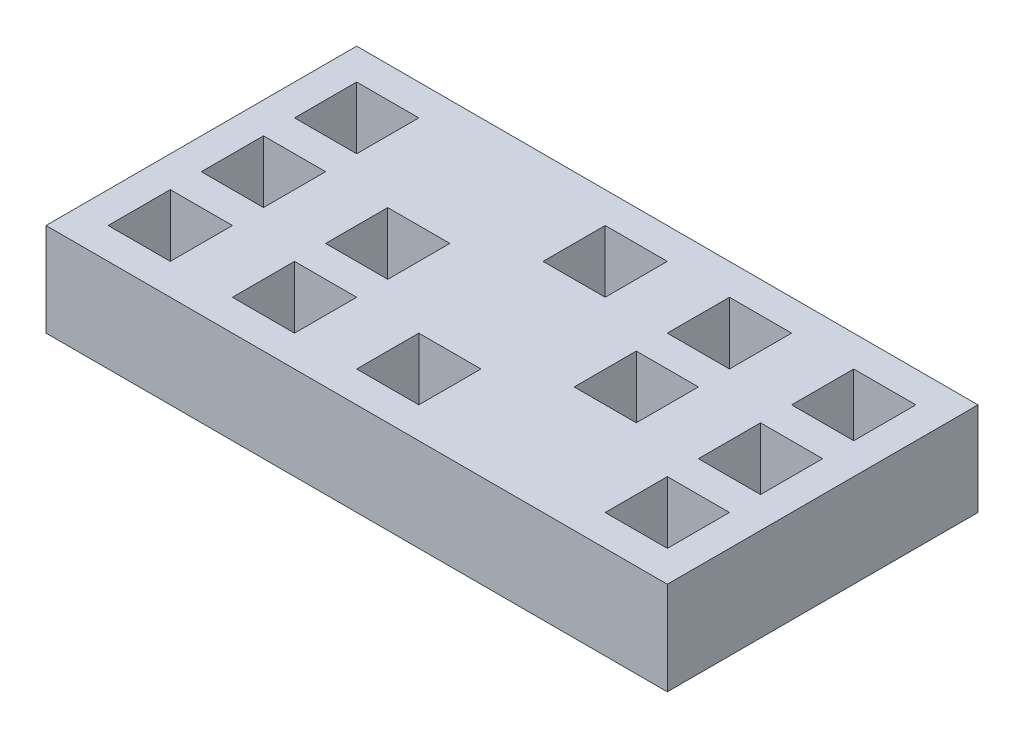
SolidWorks part; units mm, degrees
ref_plane "Front Plane" through (0, 0, 0) normal (0, 0, 1) x (1, 0, 0)
ref_plane "Top Plane" through (0, 0, 0) normal (0, 1, 0) x (1, 0, 0)
ref_plane "Right Plane" through (0, 0, 0) normal (1, 0, 0) x (0, 0, -1)
sketch "Sketch1" plane through (0, 0, 0) normal (0, 1, 0) x (1, 0, 0)
  line L0 (35, 5) -> (35, 15)
  line L1 (0, 0) -> (100, 0)
  line L2 (0, 0) -> (0, 50)
  line L3 (0, 50) -> (100, 50)
  line L4 (100, 0) -> (100, 50)
  line L5 (5, 5) -> (15, 5)
  line L6 (5, 5) -> (5, 15)
  line L7 (5, 15) -> (15, 15)
  line L8 (15, 5) -> (15, 15)
  line L9 (25, 15) -> (35, 15)
  line L10 (25, 5) -> (25, 15)
  line L11 (25, 5) -> (35, 5)
  line L12 (55, 5) -> (55, 15)
  line L13 (45, 15) -> (55, 15)
  line L14 (45, 5) -> (45, 15)
  line L15 (45, 5) -> (55, 5)
  line L20 (95, 5) -> (95, 15)
  line L21 (85, 15) -> (95, 15)
  line L22 (85, 5) -> (85, 15)
  line L23 (85, 5) -> (95, 5)
  line L24 (15, 20) -> (15, 30)
  line L25 (5, 30) -> (15, 30)
  line L26 (5, 20) -> (5, 30)
  line L27 (5, 20) -> (15, 20)
  line L28 (35, 20) -> (35, 30)
  line L29 (25, 30) -> (35, 30)
  line L30 (25, 20) -> (25, 30)
  line L31 (25, 20) -> (35, 20)
  line L36 (75, 20) -> (75, 30)
  line L37 (65, 30) -> (75, 30)
  line L38 (65, 20) -> (65, 30)
  line L39 (65, 20) -> (75, 20)
  line L40 (95, 20) -> (95, 30)
  line L41 (85, 30) -> (95, 30)
  line L42 (85, 20) -> (85, 30)
  line L43 (85, 20) -> (95, 20)
  line L44 (15, 35) -> (15, 45)
  line L45 (5, 45) -> (15, 45)
  line L46 (5, 35) -> (5, 45)
  line L47 (5, 35) -> (15, 35)
  line L52 (55, 35) -> (55, 45)
  line L53 (45, 45) -> (55, 45)
  line L54 (45, 35) -> (45, 45)
  line L55 (45, 35) -> (55, 35)
  line L56 (75, 35) -> (75, 45)
  line L57 (65, 45) -> (75, 45)
  line L58 (65, 35) -> (65, 45)
  line L59 (65, 35) -> (75, 35)
  line L60 (95, 35) -> (95, 45)
  line L61 (85, 45) -> (95, 45)
  line L62 (85, 35) -> (85, 45)
  line L63 (85, 35) -> (95, 35)
  line L64 (15, 5) -> (35, 5) construction
  line L65 (15, 5) -> (15, 20) construction
  line L66 (75, 5) -> (75, 15)
  line L67 (65, 15) -> (75, 15)
  line L68 (65, 5) -> (65, 15)
  line L69 (65, 5) -> (75, 5)
  line L70 (55, 20) -> (55, 30)
  line L71 (45, 30) -> (55, 30)
  line L72 (45, 20) -> (45, 30)
  line L73 (45, 20) -> (55, 20)
  line L74 (35, 35) -> (35, 45)
  line L75 (25, 45) -> (35, 45)
  line L76 (25, 35) -> (25, 45)
  line L77 (25, 35) -> (35, 35)
  dimension "D1" = 100
  dimension "D2" = 50
  dimension "D3" = 10
  dimension "D4" = 10
  dimension "D5" = 5
  dimension "D6" = 5
  dimension "D7" = 90
  dimension "D8" = 20
  dimension "D9" = 15
extrude "Extrude1" add sketch "Sketch1" along normal mid plane 15
